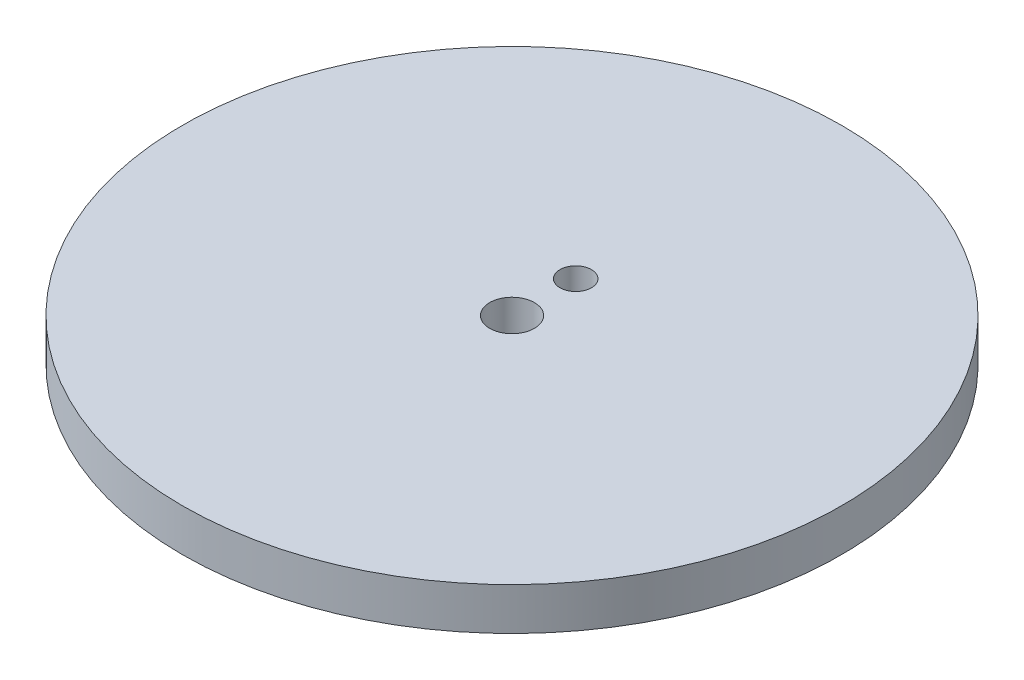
SolidWorks part; units mm, degrees
ref_plane "Front Plane" through (0, 0, 0) normal (0, 0, 1) x (1, 0, 0)
ref_plane "Top Plane" through (0, 0, 0) normal (0, 1, 0) x (1, 0, 0)
ref_plane "Right Plane" through (0, 0, 0) normal (1, 0, 0) x (0, 0, -1)
sketch "Base Sketch" plane through (0, 0, 0) normal (0, 1, 0) x (1, 0, 0)
  circle A0 centre (0, 0) radius 70
extrude "Extrude Base" add sketch "Base Sketch" along normal blind 9
sketch "Tripod Screw Location" plane through (0, 9, 0) normal (0, 1, 0) x (1, 0, 0)
  circle A0 centre (-0.0104, 0.0163) radius 4.75
  circle A1 centre (-0.0104, 13.5446) radius 3.3454
extrude "Cut Tripod Screw" cut sketch "Tripod Screw Location" against normal blind 8
sketch "Camera Screw Location" plane through (0, 0, 0) normal (0, -1, 0) x (1, 0, 0)
  circle A1 centre (0, 63.3885) radius 3.1
  circle A2 centre (54.8961, -31.6943) radius 3.1
  circle A3 centre (-54.8961, -31.6943) radius 3.1
  point P0 (0, 0)
  dimension "D1" = 3
extrude "Cut Camera Screws" cut sketch "Camera Screw Location" against normal blind 8
